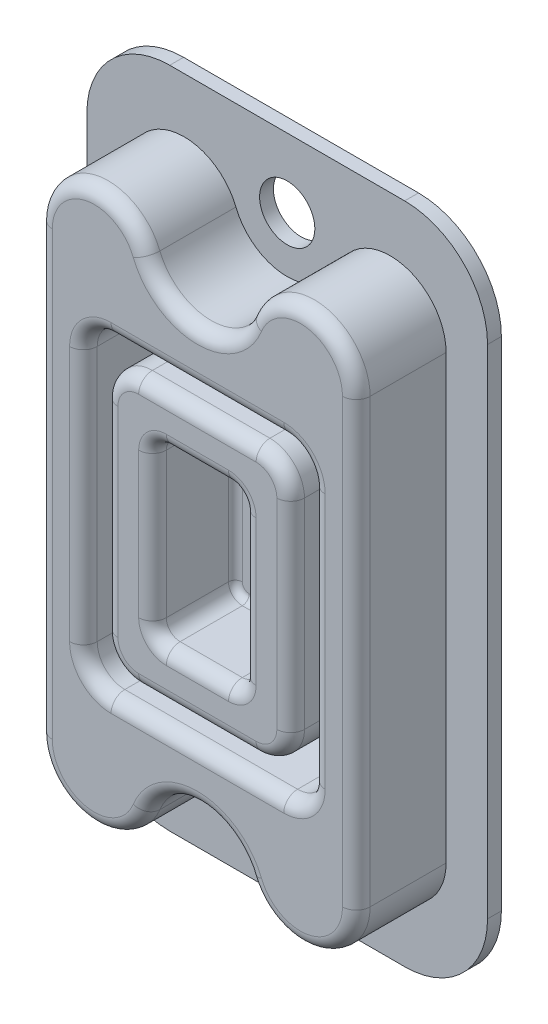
SolidWorks part; units mm, degrees
ref_plane "Face" through (0, 0, 0) normal (0, 0, 1) x (1, 0, 0)
ref_plane "Dessus" through (0, 0, 0) normal (0, 1, 0) x (1, 0, 0)
ref_plane "Droite" through (0, 0, 0) normal (1, 0, 0) x (0, 0, -1)
sketch "Esquisse1" plane through (0, 0, 0) normal (0, 0, 1) x (1, 0, 0)
  line L10 (2, 0.75) -> (6, 0.75)
  line L11 (6, 0.75) -> (6, 16)
  line L12 (27, 16) -> (27, -16)
  line L13 (6, -16) -> (6, -0.75)
  line L14 (6, -0.75) -> (2, -0.75)
  line L15 (2, -0.75) -> (2, -18)
  line L16 (8, -24) -> (25, -24)
  line L17 (31, -18) -> (31, 18)
  line L18 (25, 24) -> (8, 24)
  line L19 (2, 18) -> (2, 0.75)
  line L21 (6, -0.75) -> (6, 16)
  line L22 (27, 16) -> (27, -16)
  line L23 (6, -16) -> (6, -0.75)
  line L25 (2, 0.75) -> (2, -18)
  line L26 (8, -24) -> (25, -24)
  line L27 (31, -18) -> (31, 18)
  line L28 (25, 24) -> (8, 24)
  line L29 (2, 18) -> (2, 0.75)
  circle A0 centre (16.5, 19) radius 2 construction
  circle A1 centre (16.5, 19) radius 2
  circle A2 centre (16.5, -19) radius 2 construction
  circle A3 centre (16.5, -19) radius 2
  arc A10 (11.8611, 17.1344) -> (6, 16) centre (9.0403, 16) ccw
  arc A11 (11.8611, 17.1344) -> (21.1389, 17.1344) centre (16.5, 19) ccw
  arc A12 (27, 16) -> (21.1389, 17.1344) centre (23.9597, 16) ccw
  arc A13 (21.1389, -17.1344) -> (27, -16) centre (23.9597, -16) ccw
  arc A14 (21.1389, -17.1344) -> (11.8611, -17.1344) centre (16.5, -19) ccw
  arc A15 (6, -16) -> (11.8611, -17.1344) centre (9.0403, -16) ccw
  arc A16 (2, -18) -> (8, -24) centre (8, -18) ccw
  arc A17 (25, -24) -> (31, -18) centre (25, -18) ccw
  arc A18 (31, 18) -> (25, 24) centre (25, 18) ccw
  arc A19 (8, 24) -> (2, 18) centre (8, 18) ccw
  arc A20 (11.8611, 17.1344) -> (6, 16) centre (9.0403, 16) ccw
  arc A21 (11.8611, 17.1344) -> (21.1389, 17.1344) centre (16.5, 19) ccw
  arc A22 (27, 16) -> (21.1389, 17.1344) centre (23.9597, 16) ccw
  arc A23 (21.1389, -17.1344) -> (27, -16) centre (23.9597, -16) ccw
  arc A24 (21.1389, -17.1344) -> (11.8611, -17.1344) centre (16.5, -19) ccw
  arc A25 (6, -16) -> (11.8611, -17.1344) centre (9.0403, -16) ccw
  arc A26 (2, -18) -> (8, -24) centre (8, -18) ccw
  arc A27 (25, -24) -> (31, -18) centre (25, -18) ccw
  arc A28 (31, 18) -> (25, 24) centre (25, 18) ccw
  arc A29 (8, 24) -> (2, 18) centre (8, 18) ccw
  dimension "D1" = 0
extrude "Base-Extrusion" add sketch "Esquisse1" along normal blind 1
sketch "Esquisse2" plane through (0, 0, 1) normal (0, 0, 1) x (1, 0, 0)
  line L0 (27, -16) -> (27, 16) construction
  line L1 (6, 16) -> (6, -16) construction
  line L2 (27, -16) -> (27, 16)
  line L3 (6, 16) -> (6, -16)
  line L4 (28, -16) -> (28, 16)
  line L5 (5, 16) -> (5, -16)
  arc A0 (27, 16) -> (21.1389, 17.1344) centre (23.9597, 16) ccw construction
  arc A1 (21.1389, -17.1344) -> (27, -16) centre (23.9597, -16) ccw construction
  arc A2 (21.1389, -17.1344) -> (11.8611, -17.1344) centre (16.5, -19) ccw construction
  arc A3 (6, -16) -> (11.8611, -17.1344) centre (9.0403, -16) ccw construction
  arc A4 (11.8611, 17.1344) -> (6, 16) centre (9.0403, 16) ccw construction
  arc A5 (11.8611, 17.1344) -> (21.1389, 17.1344) centre (16.5, 19) ccw construction
  arc A6 (27, 16) -> (21.1389, 17.1344) centre (23.9597, 16) ccw
  arc A7 (21.1389, -17.1344) -> (27, -16) centre (23.9597, -16) ccw
  arc A8 (21.1389, -17.1344) -> (11.8611, -17.1344) centre (16.5, -19) ccw
  arc A9 (6, -16) -> (11.8611, -17.1344) centre (9.0403, -16) ccw
  arc A10 (11.8611, 17.1344) -> (6, 16) centre (9.0403, 16) ccw
  arc A11 (11.8611, 17.1344) -> (21.1389, 17.1344) centre (16.5, 19) ccw
  arc A12 (12.7889, 17.5075) -> (20.2111, 17.5075) centre (16.5, 19) ccw
  arc A13 (28, 16) -> (20.2111, 17.5075) centre (23.9597, 16) ccw
  arc A14 (20.2111, -17.5075) -> (28, -16) centre (23.9597, -16) ccw
  arc A15 (20.2111, -17.5075) -> (12.7889, -17.5075) centre (16.5, -19) ccw
  arc A16 (5, -16) -> (12.7889, -17.5075) centre (9.0403, -16) ccw
  arc A17 (12.7889, 17.5075) -> (5, 16) centre (9.0403, 16) ccw
  dimension "D1" = 1
extrude "Boss.-Extru.1" add sketch "Esquisse2" along normal blind 6.5
sketch "Esquisse3" plane through (0, 0, 7.5) normal (0, 0, 1) x (1, 0, 0)
  line L0 (27, -16) -> (27, 16) construction
  line L1 (6, 16) -> (6, -16) construction
  line L2 (27, -16) -> (27, 16)
  line L3 (6, 16) -> (6, -16)
  arc A0 (21.1389, -17.1344) -> (27, -16) centre (23.9597, -16) ccw construction
  arc A1 (21.1389, -17.1344) -> (11.8611, -17.1344) centre (16.5, -19) ccw construction
  arc A2 (6, -16) -> (11.8611, -17.1344) centre (9.0403, -16) ccw construction
  arc A3 (11.8611, 17.1344) -> (6, 16) centre (9.0403, 16) ccw construction
  arc A4 (11.8611, 17.1344) -> (21.1389, 17.1344) centre (16.5, 19) ccw construction
  arc A5 (27, 16) -> (21.1389, 17.1344) centre (23.9597, 16) ccw construction
  arc A6 (21.1389, -17.1344) -> (27, -16) centre (23.9597, -16) ccw
  arc A7 (21.1389, -17.1344) -> (11.8611, -17.1344) centre (16.5, -19) ccw
  arc A8 (6, -16) -> (11.8611, -17.1344) centre (9.0403, -16) ccw
  arc A9 (11.8611, 17.1344) -> (6, 16) centre (9.0403, 16) ccw
  arc A10 (11.8611, 17.1344) -> (21.1389, 17.1344) centre (16.5, 19) ccw
  arc A11 (27, 16) -> (21.1389, 17.1344) centre (23.9597, 16) ccw
extrude "Boss.-Extru.2" add sketch "Esquisse3" against normal blind 1
sketch "Esquisse4" plane through (0, 0, 7.5) normal (0, 0, 1) x (1, 0, 0)
  line L0 (25, 24) -> (8, 24) construction
  line L1 (22.75, 11.25) -> (10.25, 11.25)
  line L2 (24.75, 9.25) -> (24.75, -9.25)
  line L3 (22.75, -11.25) -> (10.25, -11.25)
  line L4 (8.25, 9.25) -> (8.25, -9.25)
  arc A0 (24.75, 9.25) -> (22.75, 11.25) centre (22.75, 9.25) ccw
  arc A1 (8.25, 9.25) -> (10.25, 11.25) centre (10.25, 9.25) cw
  arc A2 (8.25, -9.25) -> (10.25, -11.25) centre (10.25, -9.25) ccw
  arc A3 (22.75, -11.25) -> (24.75, -9.25) centre (22.75, -9.25) ccw
  point P4 (24.75, 0)
  point P5 (16.5, 24)
  point P7 (16.5, 11.25)
  point P12 (24.75, 11.25)
  point P15 (8.25, 11.25)
  point P20 (24.75, -11.25)
  dimension "D3" = 2
  dimension "D1" = 16.5
  dimension "D2" = 22.5
extrude "Enlèv. mat.-Extru.1" cut sketch "Esquisse4" against normal through all
sketch "Esquisse5" plane through (0, 0, 7.5) normal (0, 0, 1) x (1, 0, 0)
  line L0 (10.25, -11.25) -> (22.75, -11.25) construction
  line L1 (8.25, 9.25) -> (8.25, -9.25) construction
  line L2 (22.75, 11.25) -> (10.25, 11.25) construction
  line L3 (24.75, -9.25) -> (24.75, 9.25) construction
  line L4 (10.25, -11.25) -> (22.75, -11.25)
  line L5 (8.25, 9.25) -> (8.25, -9.25)
  line L6 (22.75, 11.25) -> (10.25, 11.25)
  line L7 (24.75, -9.25) -> (24.75, 9.25)
  line L10 (22.75, 12.25) -> (10.25, 12.25)
  line L11 (25.75, -9.25) -> (25.75, 9.25)
  line L12 (10.25, -12.25) -> (22.75, -12.25)
  line L13 (7.25, 9.25) -> (7.25, -9.25)
  arc A0 (22.75, -11.25) -> (24.75, -9.25) centre (22.75, -9.25) ccw construction
  arc A1 (8.25, -9.25) -> (10.25, -11.25) centre (10.25, -9.25) ccw construction
  arc A2 (10.25, 11.25) -> (8.25, 9.25) centre (10.25, 9.25) ccw construction
  arc A3 (24.75, 9.25) -> (22.75, 11.25) centre (22.75, 9.25) ccw construction
  arc A4 (22.75, -11.25) -> (24.75, -9.25) centre (22.75, -9.25) ccw
  arc A5 (8.25, -9.25) -> (10.25, -11.25) centre (10.25, -9.25) ccw
  arc A6 (10.25, 11.25) -> (8.25, 9.25) centre (10.25, 9.25) ccw
  arc A7 (24.75, 9.25) -> (22.75, 11.25) centre (22.75, 9.25) ccw
  arc A14 (25.75, 9.25) -> (22.75, 12.25) centre (22.75, 9.25) ccw
  arc A15 (22.75, -12.25) -> (25.75, -9.25) centre (22.75, -9.25) ccw
  arc A16 (7.25, -9.25) -> (10.25, -12.25) centre (10.25, -9.25) ccw
  arc A17 (10.25, 12.25) -> (7.25, 9.25) centre (10.25, 9.25) ccw
  dimension "D1" = 1
extrude "Boss.-Extru.3" add sketch "Esquisse5" against normal blind 8.5
sketch "Esquisse6" plane through (0, 0, -1) normal (0, 0, -1) x (-1, 0, 0)
  line L0 (-8.25, 9.25) -> (-8.25, -9.25) construction
  line L1 (-10.25, -11.25) -> (-22.75, -11.25) construction
  line L2 (-24.75, -9.25) -> (-24.75, 9.25) construction
  line L3 (-22.75, 11.25) -> (-10.25, 11.25) construction
  line L4 (-8.25, 9.25) -> (-8.25, -9.25)
  line L5 (-10.25, -11.25) -> (-22.75, -11.25)
  line L6 (-24.75, -9.25) -> (-24.75, 9.25)
  line L7 (-22.75, 11.25) -> (-10.25, 11.25)
  line L8 (-22.25, -7.25) -> (-22.25, 7.25)
  line L9 (-20.75, 8.75) -> (-12.25, 8.75)
  line L10 (-10.75, 7.25) -> (-10.75, -7.25)
  line L11 (-12.25, -8.75) -> (-20.75, -8.75)
  arc A0 (-8.25, 9.25) -> (-10.25, 11.25) centre (-10.25, 9.25) ccw construction
  arc A1 (-10.25, -11.25) -> (-8.25, -9.25) centre (-10.25, -9.25) ccw construction
  arc A2 (-24.75, -9.25) -> (-22.75, -11.25) centre (-22.75, -9.25) ccw construction
  arc A3 (-22.75, 11.25) -> (-24.75, 9.25) centre (-22.75, 9.25) ccw construction
  arc A4 (-8.25, 9.25) -> (-10.25, 11.25) centre (-10.25, 9.25) ccw
  arc A5 (-10.25, -11.25) -> (-8.25, -9.25) centre (-10.25, -9.25) ccw
  arc A6 (-24.75, -9.25) -> (-22.75, -11.25) centre (-22.75, -9.25) ccw
  arc A7 (-22.75, 11.25) -> (-24.75, 9.25) centre (-22.75, 9.25) ccw
  arc A8 (-10.75, 7.25) -> (-12.25, 8.75) centre (-12.25, 7.25) ccw
  arc A9 (-20.75, 8.75) -> (-22.25, 7.25) centre (-20.75, 7.25) ccw
  arc A10 (-20.75, -8.75) -> (-22.25, -7.25) centre (-20.75, -7.25) cw
  arc A11 (-12.25, -8.75) -> (-10.75, -7.25) centre (-12.25, -7.25) ccw
  dimension "D2" = 1.5
  dimension "D1" = 2.5
extrude "Boss.-Extru.4" add sketch "Esquisse6" against normal blind 1
sketch "Esquisse7" plane through (0, 0, -1) normal (0, 0, -1) x (-1, 0, 0)
  line L0 (-10.75, -7.25) -> (-10.75, 7.25) construction
  line L1 (-20.75, -8.75) -> (-12.25, -8.75) construction
  line L2 (-22.25, 7.25) -> (-22.25, -7.25) construction
  line L3 (-12.25, 8.75) -> (-20.75, 8.75) construction
  line L4 (-10.75, -7.25) -> (-10.75, 7.25)
  line L5 (-20.75, -8.75) -> (-12.25, -8.75)
  line L6 (-22.25, 7.25) -> (-22.25, -7.25)
  line L7 (-12.25, 8.75) -> (-20.75, 8.75)
  line L8 (-12.25, 9.75) -> (-20.75, 9.75)
  line L9 (-9.75, -7.25) -> (-9.75, 7.25)
  line L10 (-20.75, -9.75) -> (-12.25, -9.75)
  line L11 (-23.25, 7.25) -> (-23.25, -7.25)
  arc A0 (-10.75, 7.25) -> (-12.25, 8.75) centre (-12.25, 7.25) ccw construction
  arc A1 (-12.25, -8.75) -> (-10.75, -7.25) centre (-12.25, -7.25) ccw construction
  arc A2 (-22.25, -7.25) -> (-20.75, -8.75) centre (-20.75, -7.25) ccw construction
  arc A3 (-20.75, 8.75) -> (-22.25, 7.25) centre (-20.75, 7.25) ccw construction
  arc A4 (-10.75, 7.25) -> (-12.25, 8.75) centre (-12.25, 7.25) ccw
  arc A5 (-12.25, -8.75) -> (-10.75, -7.25) centre (-12.25, -7.25) ccw
  arc A6 (-22.25, -7.25) -> (-20.75, -8.75) centre (-20.75, -7.25) ccw
  arc A7 (-20.75, 8.75) -> (-22.25, 7.25) centre (-20.75, 7.25) ccw
  arc A8 (-9.75, 7.25) -> (-12.25, 9.75) centre (-12.25, 7.25) ccw
  arc A9 (-12.25, -9.75) -> (-9.75, -7.25) centre (-12.25, -7.25) ccw
  arc A10 (-23.25, -7.25) -> (-20.75, -9.75) centre (-20.75, -7.25) ccw
  arc A11 (-20.75, 9.75) -> (-23.25, 7.25) centre (-20.75, 7.25) ccw
  dimension "D1" = 1
extrude "Boss.-Extru.5" add sketch "Esquisse7" against normal blind 8.5
sketch "Esquisse8" plane through (0, 0, 7.5) normal (0, 0, 1) x (1, 0, 0)
  line L0 (18.75, 6.25) -> (14.25, 6.25)
  line L1 (19.75, -5.25) -> (19.75, 5.25)
  line L2 (14.25, -6.25) -> (18.75, -6.25)
  line L3 (13.25, 5.25) -> (13.25, -5.25)
  line L4 (9.75, 7.25) -> (9.75, -7.25)
  line L5 (12.25, -9.75) -> (20.75, -9.75)
  line L6 (23.25, -7.25) -> (23.25, 7.25)
  line L7 (20.75, 9.75) -> (12.25, 9.75)
  line L8 (9.75, 7.25) -> (9.75, -7.25)
  line L9 (12.25, -9.75) -> (20.75, -9.75)
  line L10 (23.25, -7.25) -> (23.25, 7.25)
  line L11 (20.75, 9.75) -> (12.25, 9.75)
  arc A0 (19.75, 5.25) -> (18.75, 6.25) centre (18.75, 5.25) ccw
  arc A1 (13.25, 5.25) -> (14.25, 6.25) centre (14.25, 5.25) cw
  arc A2 (13.25, -5.25) -> (14.25, -6.25) centre (14.25, -5.25) ccw
  arc A3 (18.75, -6.25) -> (19.75, -5.25) centre (18.75, -5.25) ccw
  arc A4 (12.25, 9.75) -> (9.75, 7.25) centre (12.25, 7.25) ccw
  arc A5 (9.75, -7.25) -> (12.25, -9.75) centre (12.25, -7.25) ccw
  arc A6 (20.75, -9.75) -> (23.25, -7.25) centre (20.75, -7.25) ccw
  arc A7 (23.25, 7.25) -> (20.75, 9.75) centre (20.75, 7.25) ccw
  arc A8 (12.25, 9.75) -> (9.75, 7.25) centre (12.25, 7.25) ccw
  arc A9 (9.75, -7.25) -> (12.25, -9.75) centre (12.25, -7.25) ccw
  arc A10 (20.75, -9.75) -> (23.25, -7.25) centre (20.75, -7.25) ccw
  arc A11 (23.25, 7.25) -> (20.75, 9.75) centre (20.75, 7.25) ccw
  dimension "D3" = 1
  dimension "D1" = 0
  dimension "D2" = 3.5
extrude "Boss.-Extru.6" add sketch "Esquisse8" against normal blind 1
sketch "Esquisse9" plane through (0, 0, 7.5) normal (0, 0, 1) x (1, 0, 0)
  line L0 (14.25, -6.25) -> (18.75, -6.25) construction
  line L1 (19.75, -5.25) -> (19.75, 5.25) construction
  line L2 (18.75, 6.25) -> (14.25, 6.25) construction
  line L3 (13.25, 5.25) -> (13.25, -5.25) construction
  line L4 (14.25, -6.25) -> (18.75, -6.25)
  line L5 (19.75, -5.25) -> (19.75, 5.25)
  line L6 (18.75, 6.25) -> (14.25, 6.25)
  line L7 (13.25, 5.25) -> (13.25, -5.25)
  line L8 (18.75, 7.25) -> (14.25, 7.25)
  line L9 (20.75, -5.25) -> (20.75, 5.25)
  line L10 (14.25, -7.25) -> (18.75, -7.25)
  line L11 (12.25, 5.25) -> (12.25, -5.25)
  arc A0 (13.25, -5.25) -> (14.25, -6.25) centre (14.25, -5.25) ccw construction
  arc A1 (18.75, -6.25) -> (19.75, -5.25) centre (18.75, -5.25) ccw construction
  arc A2 (19.75, 5.25) -> (18.75, 6.25) centre (18.75, 5.25) ccw construction
  arc A3 (14.25, 6.25) -> (13.25, 5.25) centre (14.25, 5.25) ccw construction
  arc A4 (13.25, -5.25) -> (14.25, -6.25) centre (14.25, -5.25) ccw
  arc A5 (18.75, -6.25) -> (19.75, -5.25) centre (18.75, -5.25) ccw
  arc A6 (19.75, 5.25) -> (18.75, 6.25) centre (18.75, 5.25) ccw
  arc A7 (14.25, 6.25) -> (13.25, 5.25) centre (14.25, 5.25) ccw
  arc A8 (20.75, 5.25) -> (18.75, 7.25) centre (18.75, 5.25) ccw
  arc A9 (18.75, -7.25) -> (20.75, -5.25) centre (18.75, -5.25) ccw
  arc A10 (12.25, -5.25) -> (14.25, -7.25) centre (14.25, -5.25) ccw
  arc A11 (14.25, 7.25) -> (12.25, 5.25) centre (14.25, 5.25) ccw
  dimension "D1" = 1
extrude "Boss.-Extru.7" add sketch "Esquisse9" against normal blind 7
sketch "Esquisse10" plane through (0, 0, 0.5) normal (0, 0, -1) x (-1, 0, 0)
  line L0 (-14.25, -7.25) -> (-18.75, -7.25) construction
  line L1 (-20.75, -5.25) -> (-20.75, 5.25) construction
  line L2 (-18.75, 7.25) -> (-14.25, 7.25) construction
  line L3 (-12.25, 5.25) -> (-12.25, -5.25) construction
  line L4 (-14.25, -7.25) -> (-18.75, -7.25)
  line L5 (-20.75, -5.25) -> (-20.75, 5.25)
  line L6 (-18.75, 7.25) -> (-14.25, 7.25)
  line L7 (-12.25, 5.25) -> (-12.25, -5.25)
  arc A0 (-14.25, -7.25) -> (-12.25, -5.25) centre (-14.25, -5.25) ccw construction
  arc A1 (-20.75, -5.25) -> (-18.75, -7.25) centre (-18.75, -5.25) ccw construction
  arc A2 (-18.75, 7.25) -> (-20.75, 5.25) centre (-18.75, 5.25) ccw construction
  arc A3 (-12.25, 5.25) -> (-14.25, 7.25) centre (-14.25, 5.25) ccw construction
  arc A4 (-14.25, -7.25) -> (-12.25, -5.25) centre (-14.25, -5.25) ccw
  arc A5 (-20.75, -5.25) -> (-18.75, -7.25) centre (-18.75, -5.25) ccw
  arc A6 (-18.75, 7.25) -> (-20.75, 5.25) centre (-18.75, 5.25) ccw
  arc A7 (-12.25, 5.25) -> (-14.25, 7.25) centre (-14.25, 5.25) ccw
extrude "Boss.-Extru.8" add sketch "Esquisse10" against normal blind 1
fillet "Congé1" radius 1
fillet "Congé3" radius 0.5
